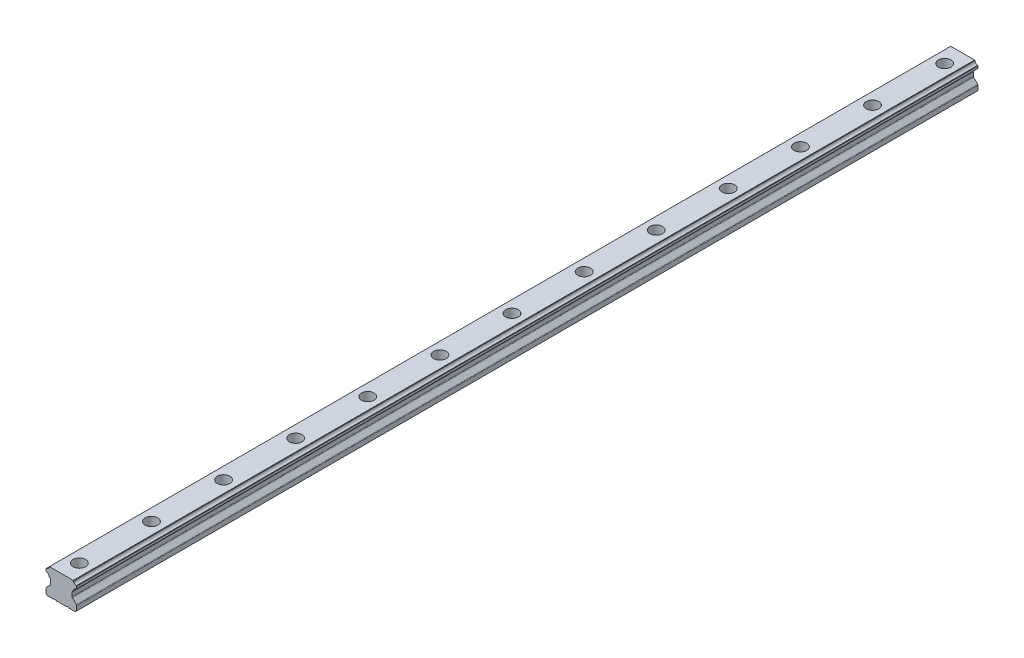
SolidWorks part; units mm, degrees
ref_plane "Front Plane" through (0, 0, 0) normal (0, 0, 1) x (1, 0, 0)
ref_plane "Top Plane" through (0, 0, 0) normal (0, 1, 0) x (1, 0, 0)
ref_plane "Right Plane" through (0, 0, 0) normal (1, 0, 0) x (0, 0, -1)
sketch "Sketch2" plane through (0, 0, 0) normal (0, 0, 1) x (1, 0, 0)
  line L0 (12.516, 3.8699) -> (13.8905, 5.2444)
  line L1 (16.899, 8.2529) -> (17.2645, 8.6184)
  line L2 (17.2645, 8.6184) -> (17.2645, 11.1313)
  line L3 (17.2645, 11.1313) -> (16.8871, 11.5087)
  line L4 (13.8914, 14.5045) -> (13.516, 14.8799)
  line L5 (13.516, 14.8799) -> (-12.9869, 14.8799)
  line L6 (-12.9869, 14.8799) -> (-13.3623, 14.5045)
  line L7 (-16.3581, 11.5087) -> (-16.7355, 11.1313)
  line L8 (-16.7355, 11.1313) -> (-16.7355, 8.6184)
  line L9 (-16.7355, 8.6184) -> (-16.3699, 8.2529)
  line L10 (-13.3614, 5.2444) -> (-11.9869, 3.8699)
  line L11 (-11.6355, 3.0214) -> (-11.6355, -1.3817)
  line L12 (-11.9869, -2.2302) -> (-16.384, -6.6273)
  line L13 (-16.7355, -7.4758) -> (-16.7355, -12.6201)
  line L14 (-16.7355, -12.6201) -> (-15.2355, -14.1201)
  line L15 (-15.2355, -14.1201) -> (-8.4855, -14.1201)
  line L16 (-8.4855, -14.1201) -> (-7.9855, -13.6201)
  line L17 (-7.9855, -13.6201) -> (-6.0855, -13.6201)
  line L18 (-6.0855, -13.6201) -> (-5.5855, -14.1201)
  line L19 (-5.5855, -14.1201) -> (6.1145, -14.1201)
  line L20 (6.1145, -14.1201) -> (6.6145, -13.6201)
  line L21 (6.6145, -13.6201) -> (8.5145, -13.6201)
  line L22 (8.5145, -13.6201) -> (9.0145, -14.1201)
  line L23 (9.0145, -14.1201) -> (15.7645, -14.1201)
  line L24 (15.7645, -14.1201) -> (17.2645, -12.6201)
  line L25 (17.2645, -12.6201) -> (17.2645, -7.4758)
  line L26 (16.9131, -6.6273) -> (12.516, -2.2302)
  line L27 (12.1645, -1.3817) -> (12.1645, 3.0214)
  arc A0 (12.516, 3.8699) -> (12.1645, 3.0214) centre (13.3645, 3.0214) ccw
  arc A1 (16.899, 8.2529) -> (13.8905, 5.2444) centre (17.1321, 5.0113) ccw
  arc A2 (13.8914, 14.5045) -> (16.8871, 11.5087) centre (17.1321, 14.7494) ccw
  arc A3 (-16.3581, 11.5087) -> (-13.3623, 14.5045) centre (-16.603, 14.7494) ccw
  arc A4 (-13.3614, 5.2444) -> (-16.3699, 8.2529) centre (-16.603, 5.0113) ccw
  arc A5 (-11.6355, 3.0214) -> (-11.9869, 3.8699) centre (-12.8355, 3.0214) ccw
  arc A6 (-11.9869, -2.2302) -> (-11.6355, -1.3817) centre (-12.8355, -1.3817) ccw
  arc A7 (-16.384, -6.6273) -> (-16.7355, -7.4758) centre (-15.5355, -7.4758) ccw
  arc A8 (17.2645, -7.4758) -> (16.9131, -6.6273) centre (16.0645, -7.4758) ccw
  arc A9 (12.1645, -1.3817) -> (12.516, -2.2302) centre (13.3645, -1.3817) ccw
extrude "Boss-Extrude1" add sketch "Sketch2" along normal blind 1000
sketch "Sketch3" plane through (0, 14.8799, 0) normal (0, 1, 0) x (1, 0, 0)
  line L0 (13.516, 0) -> (-12.9869, 0) construction
  line L1 (17.2645, -1000) -> (17.2645, 0) construction
  point P0 (0.2645, -20)
  dimension "D1" = 20
  dimension "D2" = 17
hole_wizard "CBORE for M16 Hex Head Bolt1" positions "Sketch3" profile "Sketch4" counterbore size "M16" standard "DIN"
sketch "Sketch4" plane through (0.2645, 14.8799, 20) normal (1, 0, 0) x (0, 0, 1)
  line L0 (0, 0) -> (0, 29)
  line L1 (0, 29) -> (4.5, 29)
  line L3 (4.5, 29) -> (4.5, 12)
  line L4 (4.5, 12) -> (7, 12)
  line L5 (7, 12) -> (7, 0)
  line L7 (7, 0) -> (0, 0)
  line L11 (0, -6.35) -> (0, 107.95) construction
  dimension "Thru Hole Dia." = 9
  dimension "Thru Hole Depth" = 29
  dimension "C'Bore Dia." = 14
  dimension "C'Bore Depth" = 12
other "Fill Pattern1" parameters "D5"=0, "D6"=0, "D1"=80, "D2"=60, "D3"=0, "D9"=13, "D7"=13, "D8"=2
